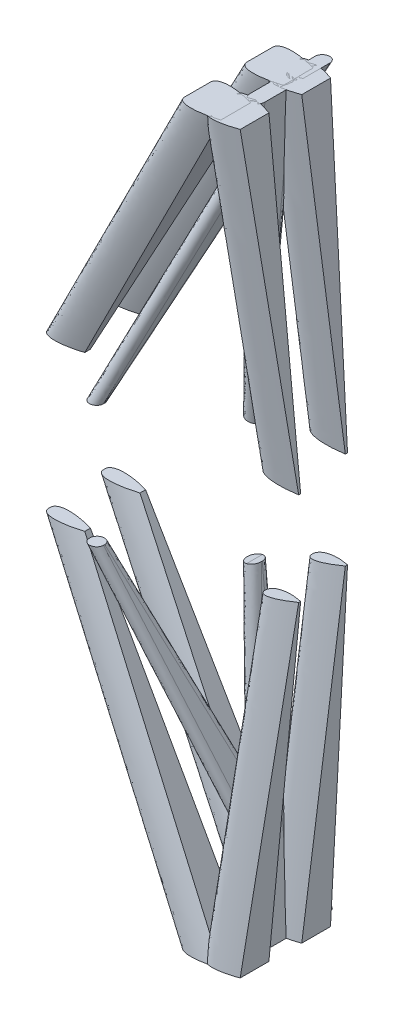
SolidWorks part; units mm, degrees
ref_plane "Piano frontale" through (0, 0, 0) normal (0, 0, 1) x (1, 0, 0)
ref_plane "Piano superiore" through (0, 0, 0) normal (0, 1, 0) x (1, 0, 0)
ref_plane "Piano destro" through (0, 0, 0) normal (1, 0, 0) x (0, 0, -1)
imported_body "Importato1"
imported_body "Importato2"
imported_body "Importato3"
imported_body "Importato4"
imported_body "Importato5"
imported_body "Importato6"
mirror "Specchia1" about plane through (0, 0, 0) normal (0, 1, 0)
